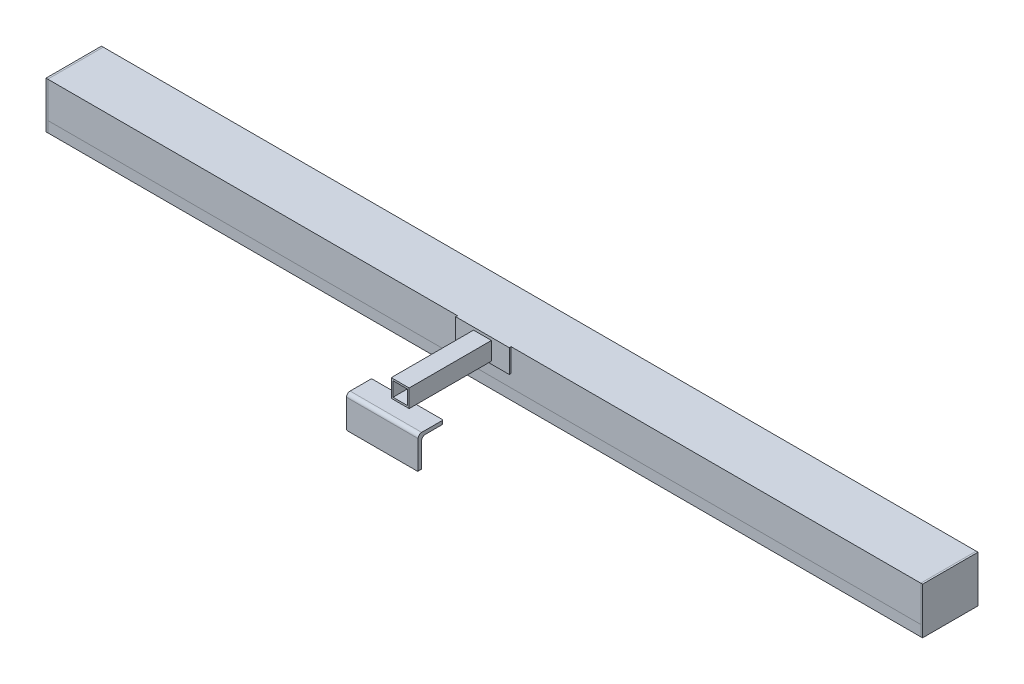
SolidWorks part; units mm, degrees
ref_plane "Alzado" through (0, 0, 0) normal (0, 0, 1) x (1, 0, 0)
ref_plane "Planta" through (0, 0, 0) normal (0, 1, 0) x (1, 0, 0)
ref_plane "Vista lateral" through (0, 0, 0) normal (1, 0, 0) x (0, 0, -1)
sketch "Croquis1" plane through (0, 0, 0) normal (0, 0, 1) x (1, 0, 0)
  line L0 (0, -9) -> (0, 9) construction
  line L1 (-20, 0) -> (20, 0) construction
  line L3 (-20, -9) -> (20, -9)
  line L4 (-20, -9) -> (-20, 9)
  line L5 (-20, 9) -> (20, 9)
  line L6 (20, -9) -> (20, 9)
  point P4 (0, 0)
  point P8 (0, 0)
  point P12 (0, 0)
  point P13 (0, 0)
  dimension "D1" = 18
  dimension "D2" = 40
extrude "Saliente-Extruir1" add sketch "Croquis1" along normal blind 2
sketch "Croquis2" plane through (0, 9, 0) normal (0, 1, 0) x (1, 0, 0)
  line L0 (0, -2) -> (0, 12) construction
  line L1 (20, -2) -> (-20, -2) construction
  line L2 (0, 12) -> (-20, 12)
  line L3 (-20, 12) -> (-20, -2)
  line L4 (-20, -2) -> (20, -2)
  line L5 (20, -2) -> (20, 12)
  line L6 (20, 12) -> (0, 12)
  dimension "D1" = 14
extrude "Saliente-Extruir2" add sketch "Croquis2" against normal blind 2
fillet "Redondeo1" radius 2 1 edges at (0, 7, 0)
fillet "Redondeo2" radius 2 1 edges at (0, 9, 2)
fillet "Redondeo3" radius 0.5 1 edges at (20, -9, 1)
fillet "Redondeo4" radius 0.5 1 edges at (-20, -9, 1)
fillet "Redondeo5" radius 0.5 1 edges at (-20, 8, -12)
fillet "Redondeo6" radius 0.5 1 edges at (20, 8, -12)
ref_plane "Plano1" through (0, 0, -8) normal (0, 0, 1) x (1, 0, 0)
sketch "Croquis5" plane through (0, 0, -8) normal (0, 0, 1) x (1, 0, 0)
  line L0 (0, 9) -> (0, 13.0338) construction
  line L1 (-20, 9) -> (20, 9) construction
  line L2 (-5, 9) -> (5, 9)
  line L3 (-4, 10) -> (-4, 18)
  line L4 (-5, 9) -> (5, 9)
  line L5 (-5, 9) -> (-5, 19)
  line L6 (-5, 19) -> (5, 19)
  line L7 (5, 9) -> (5, 19)
  line L8 (-4, 18) -> (4, 18)
  line L9 (4, 10) -> (4, 18)
  line L10 (-4, 10) -> (4, 10)
  point P8 (0, 9)
  dimension "D1" = 1
extrude "Saliente-Extruir3" add sketch "Croquis5" against normal blind 46
sketch "Croquis6" plane through (0, 0, -54) normal (0, 0, -1) x (-1, 0, 0)
  line L0 (0, 19) -> (0, 9) construction
  line L1 (5, 19) -> (-5, 19) construction
  line L2 (5, 9) -> (-5, 9) construction
  line L3 (-15, 14) -> (15, 14) construction
  line L4 (0, 7.5) -> (0, 20.5) construction
  line L6 (-15, 7.5) -> (15, 7.5)
  line L7 (-15, 7.5) -> (-15, 20.5)
  line L8 (-15, 20.5) -> (15, 20.5)
  line L9 (15, 7.5) -> (15, 20.5)
  point P9 (0, 14)
  point P13 (0, 14)
  point P17 (0, 0)
  point P18 (0, 0)
  dimension "D1" = 13
  dimension "D2" = 30
extrude "Saliente-Extruir4" add sketch "Croquis6" along normal blind 1
sketch "Croquis7" plane through (0, 0, -55) normal (0, 0, -1) x (-1, 0, 0)
  line L0 (-244, 20.5) -> (244, 20.5)
  line L1 (0, 0) -> (0, 20.5) construction
  line L2 (244, 20.5) -> (244, 0.5)
  line L3 (244, 0.5) -> (-244, 0.5)
  line L4 (-244, 0.5) -> (-244, 20.5)
  point P3 (0, 20.5)
  dimension "D1" = 488
  dimension "D2" = 20
extrude "Saliente-Extruir5" add sketch "Croquis7" along normal blind 31
sketch "Croquis9" plane through (0, 0.5, 0) normal (0, -1, 0) x (1, 0, 0)
  line L1 (-244, -55) -> (244, -55)
  line L2 (-244, -55) -> (-244, -86)
  line L3 (-244, -86) -> (244, -86)
  line L4 (244, -55) -> (244, -86)
extrude "Saliente-Extruir7" add sketch "Croquis9" along normal blind 6 separate body
sketch "Croquis10" plane through (-244, 0, 0) normal (-1, 0, 0) x (0, 0, 1)
  line L1 (-86, 20.5) -> (-55, 20.5)
  line L2 (-86, 20.5) -> (-86, -5.5)
  line L3 (-86, -5.5) -> (-55, -5.5)
  line L4 (-55, 20.5) -> (-55, -5.5)
extrude "Saliente-Extruir8" add sketch "Croquis10" along normal blind 1 separate body
sketch "Croquis11" plane through (244, 0, 0) normal (1, 0, 0) x (0, 0, -1)
  line L1 (55, 20.5) -> (86, 20.5)
  line L2 (55, 20.5) -> (55, -5.5)
  line L3 (55, -5.5) -> (86, -5.5)
  line L4 (86, 20.5) -> (86, -5.5)
extrude "Saliente-Extruir9" add sketch "Croquis11" along normal blind 1 separate body
sketch "Croquis12" plane through (245, 0, 0) normal (1, 0, 0) x (0, 0, -1)
  line L1 (55, -5.5) -> (55, 20.5)
  line L3 (55, 20.5) -> (86, 20.5)
  line L4 (86, 20.5) -> (86, -5.5)
  line L5 (70.5, 20.5) -> (70.5, -5.5) construction
  line L6 (55, -5.5) -> (86, -5.5) construction
  line L7 (55, 7.5) -> (86, 7.5) construction
  line L8 (86, -5.5) -> (86, 20.5) construction
  line L9 (86, -5.5) -> (55, -5.5)
  arc A0 (84.607, -4.9143) -> (85.4555, -4.0729) centre (84.4666, -3.9242) ccw
  arc A1 (85.4555, 19.0729) -> (84.607, 19.9143) centre (84.4666, 18.9242) ccw
  arc A2 (56.393, 19.9143) -> (55.5445, 19.0729) centre (56.5334, 18.9242) ccw
  arc A3 (55.5445, -4.0729) -> (56.393, -4.9143) centre (56.5334, -3.9242) ccw
  ellipse E0 centre (70.5, -4.5) end of major axis (86, -4.5) minor radius 1 (56.393, -4.9143) -> (84.607, -4.9143) ccw
  ellipse E1 centre (56, 7.5) end of major axis (56, -5.5) minor radius 1 (55.5445, 19.0729) -> (55.5445, -4.0729) ccw
  ellipse E3 centre (85, 7.5) end of major axis (85, 20.5) minor radius 1 (85.4555, -4.0729) -> (85.4555, 19.0729) ccw
  ellipse E6 centre (70.5, 19.5) end of major axis (55, 19.5) minor radius 1 (84.607, 19.9143) -> (56.393, 19.9143) ccw
  point P5 (70.5, 20.5)
  point P8 (55, 7.5)
  point P42 (0, 0)
  dimension "D1" = 1
  dimension "D2" = 1
